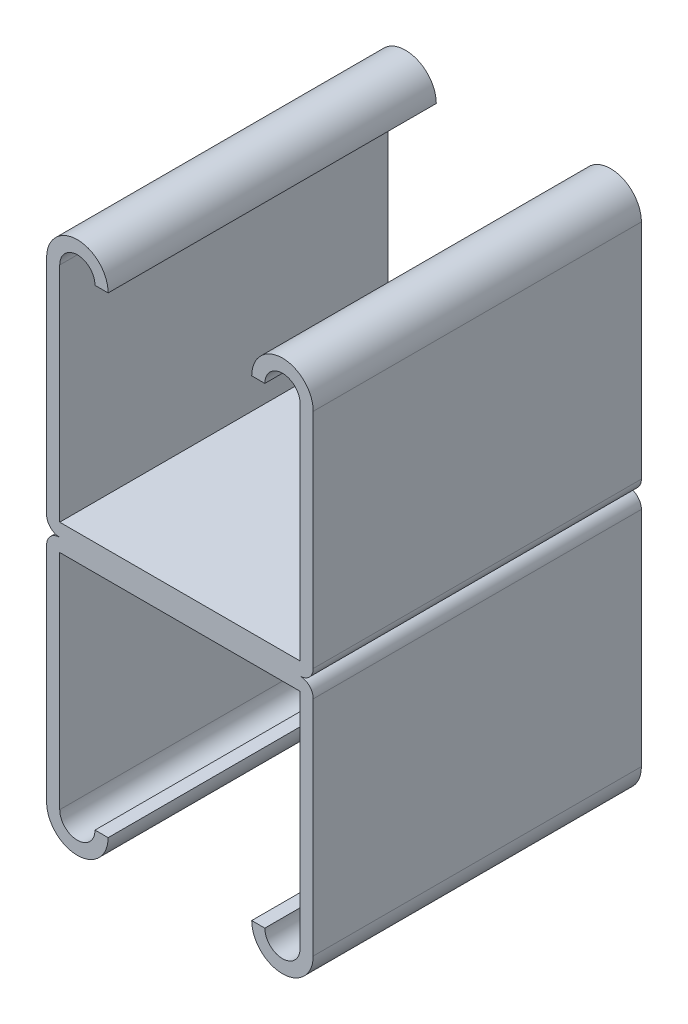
SolidWorks part; units mm, degrees
ref_plane "Plane1" through (0, 0, 0) normal (0, 0, 1) x (1, 0, 0)
ref_plane "Plane2" through (0, 0, 0) normal (0, 1, 0) x (1, 0, 0)
ref_plane "Plane3" through (0, 0, 0) normal (1, 0, 0) x (0, 0, -1)
sketch "Sketch1" plane through (0, 0, 0) normal (0, 0, 1) x (1, 0, 0)
  line L0 (-10.3188, 18.2563) -> (-10.3187, 1.016)
  line L1 (-9.3028, 0) -> (9.3027, 0)
  line L2 (10.3187, 1.016) -> (10.3187, 18.2562)
  line L3 (-6.5723, 18.2563) -> (-5.5563, 18.2563)
  line L4 (5.5562, 18.2562) -> (6.5722, 18.2562)
  line L6 (-9.3028, 18.2563) -> (-9.3027, 1.016)
  line L7 (-9.3027, 1.016) -> (9.3027, 1.016)
  line L8 (9.3027, 1.016) -> (9.3027, 18.2562)
  line L10 (-25.4, 20.6375) -> (25.4, 20.6375) construction
  arc A0 (10.3187, 18.2562) -> (5.5562, 18.2562) centre (7.9375, 18.2562) ccw
  arc A1 (-10.3188, 18.2563) -> (-5.5563, 18.2563) centre (-7.9375, 18.2563) cw
  arc A2 (-9.3028, 0) -> (-10.3187, 1.016) centre (-9.3028, 1.016) cw
  arc A3 (9.3027, 0) -> (10.3187, 1.016) centre (9.3027, 1.016) ccw
  arc A4 (-9.3028, 18.2563) -> (-6.5723, 18.2563) centre (-7.9375, 18.2563) cw
  arc A5 (9.3027, 18.2562) -> (6.5722, 18.2562) centre (7.9375, 18.2562) ccw
  dimension "D1" = 1.016
  dimension "D3" = 10.3187
  dimension "D4" = 1.016
  dimension "Width" = 20.6375
  dimension "D5" = 11.1125
  dimension "D6" = 4.7625
  dimension "D8" = 20.6375
  dimension "D2" = 4.7625
  dimension "gauge" = 1.016
extrude "Base-Extrude" add sketch "Sketch1" along normal mid plane 25.4
mirror "Mirror1" about plane through (0, 0, 0) normal (0, 1, 0) of "Base-Extrude"
equation "\"D3@Sketch1\" = \"Width@Sketch1\" / 2"
equation "\"D1@Sketch1\" = \"gauge@Sketch1\""
